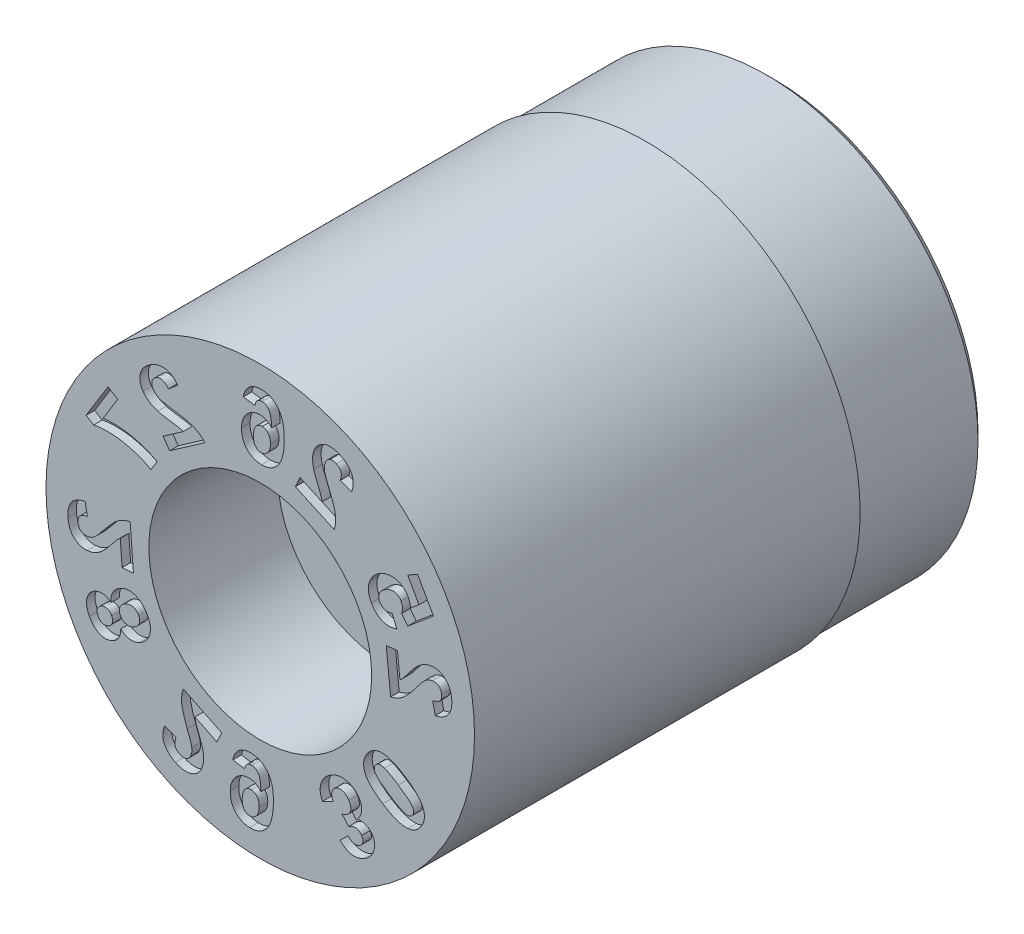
SolidWorks part; units mm, degrees
ref_plane "Front Plane" through (0, 0, 0) normal (0, 0, 1) x (1, 0, 0)
ref_plane "Top Plane" through (0, 0, 0) normal (0, 1, 0) x (1, 0, 0)
ref_plane "Right Plane" through (0, 0, 0) normal (1, 0, 0) x (0, 0, -1)
sketch "Sketch1" plane through (0, 0, 0) normal (1, 0, 0) x (0, 0, -1)
  line L2 (0, 5) -> (0, 2.6)
  line L3 (11.75, 5) -> (0, 5)
  line L4 (-3.7979, 0) -> (49996.2021, 0) construction
  line L8 (12, 1.25) -> (3, 1.25)
  line L9 (3, 2.6) -> (3, 1.25)
  line L10 (3, 2.6) -> (0, 2.6)
  line L12 (12, 1.25) -> (12, 4.75)
  line L16 (12, 4.75) -> (11.75, 5)
  dimension "D1" = 12
  dimension "D2" = 45
  dimension "D3" = 0.25
  dimension "D4" = 10
  dimension "D5" = 5.2
  dimension "D6" = 3
  dimension "D7" = 2.5
revolve "Revolve1" add sketch "Sketch1" angle 360 about L4
sketch "Sketch4" plane through (0, 0, 0) normal (1, 0, 0) x (0, 0, -1)
  line L0 (0, 0) -> (50000, 0) construction
  line L1 (12, -4.75) -> (12, 4.75) construction
  line L2 (9, 5.935) -> (12, 5.935)
  line L3 (9, 5.935) -> (9, 4.935)
  line L4 (9, 4.935) -> (12, 4.935)
  line L5 (12, 5.935) -> (12, 4.935)
  line L6 (11.75, 5) -> (0, 5) construction
  line L9 (0, 5.5) -> (0, -5.5) construction
  dimension "D1" = 1
  dimension "D2" = 0.065
  dimension "D3" = 9
revolve "Cut-Revolve1" cut sketch "Sketch4" angle 360 about L0
sketch "Sketch5" plane through (0, 0, 0) normal (0, 0, 1) x (1, 0, 0)
  circle A0 centre (0, 0) radius 3.0592 construction
  arc A1 (3.0481, -0.2599) -> (2.9049, -0.9593) centre (0, 0) ccw construction
  text T0 "25 26 27 28 29 30" font "Arial" height 1.5
  dimension "D1" = 6.1184
extrude "Cut-Extrude1" cut sketch "Sketch5" against normal blind 0.2
